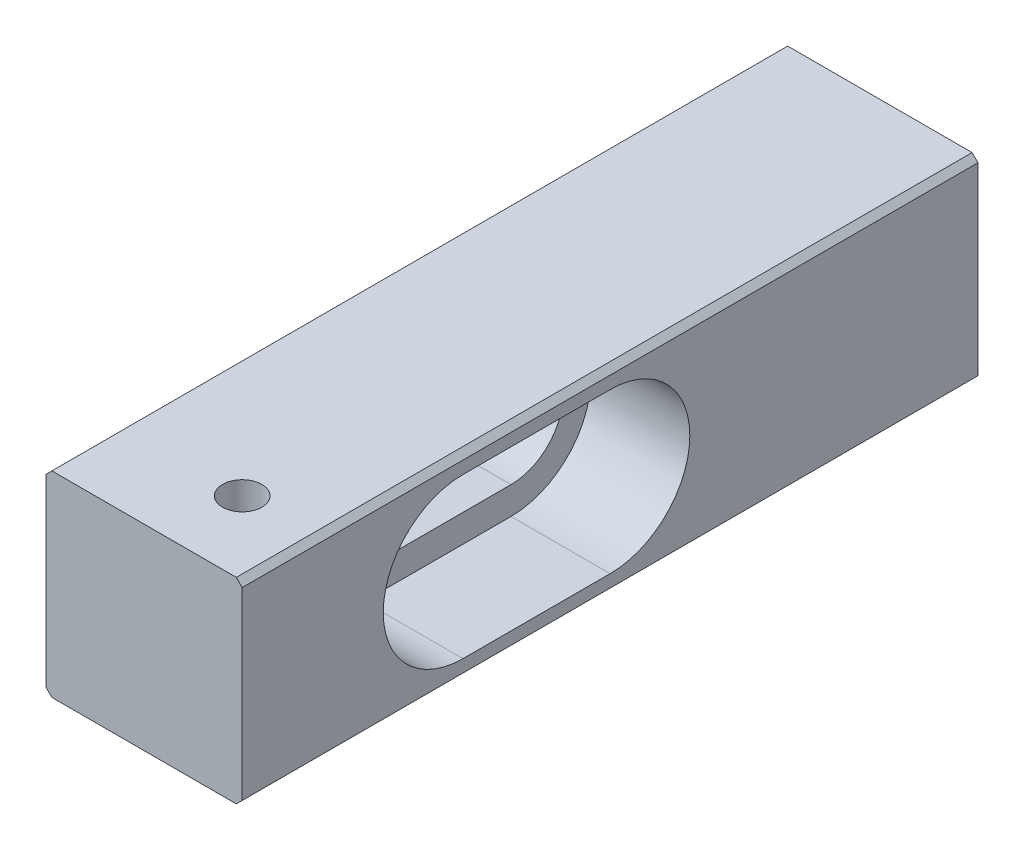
SolidWorks part; units mm, degrees
ref_plane "Front" through (0, 0, 0) normal (0, 0, 1) x (1, 0, 0)
ref_plane "Top" through (0, 0, 0) normal (0, 1, 0) x (1, 0, 0)
ref_plane "Right" through (0, 0, 0) normal (1, 0, 0) x (0, 0, -1)
sketch "Sketch1" plane through (0, 0, 0) normal (0, 0, 1) x (1, 0, 0)
  line L0 (-6.35, 12.7) -> (0, 12.7) construction
  line L1 (-6.35, -12.7) -> (19.05, -12.7)
  line L2 (-6.35, -12.7) -> (-6.35, 12.7)
  line L3 (-6.35, 12.7) -> (19.05, 12.7)
  line L4 (19.05, -12.7) -> (19.05, 12.7)
  dimension "D1" = 25.4
extrude "Boss-Extrude1" add sketch "Sketch1" along normal blind 95.25 separate body
hole_wizard "Hole1" positions "Point_Sketch" profile "Profil_Sketch" size "1/4" standard "ANSI Inch"
sketch "Point_Sketch" plane through (19.05, 0.935, 47.7941) normal (-1, 0, 0) x (0, 0, -1)
  line L1 (9.6941, 0.935) -> (-9.3559, 0.935) construction
  point P0 (0.1691, 0.935)
  dimension "D1" = 19.05
sketch "Profil_Sketch" plane through (19.05, 0, 47.625) normal (0, 1, 0) x (0, 0, -1)
  line L0 (0, 0) -> (0, 25.4)
  line L1 (0, 25.4) -> (6.7469, 25.4)
  line L3 (6.7469, 25.4) -> (6.7469, 12.827)
  line L4 (6.7469, 12.827) -> (10.3187, 12.827)
  line L5 (10.3187, 12.827) -> (10.3187, 0)
  line L7 (10.3187, 0) -> (0, 0)
  line L11 (0, -6.35) -> (0, 107.95) construction
  dimension "Diameter" = 13.4937
  dimension "Thru Hole Depth" = 25.4
  dimension "L1" = 12.827
other "usin_LS160<1>"
hole_wizard "Hole11" positions "Point_Sketch1" profile "Profil_Sketch1" tap size "1/4-20" standard "ANSI Inch"
sketch "Point_Sketch1" plane through (7.1081, -12.7, 69.9307) normal (0, 1, 0) x (-1, 0, 0)
  point P0 (-2.4169, 15.7943)
sketch "Profil_Sketch1" plane through (9.525, -12.7, 85.725) normal (1, 0, 0) x (0, 0, -1)
  line L0 (0, 0) -> (0, 25.4)
  line L1 (0, 25.4) -> (2.5527, 25.4)
  line L2 (2.5527, 25.4) -> (2.5527, 0)
  line L5 (2.5527, 0) -> (0, 0)
  line L11 (0, -6.35) -> (0, 107.95) construction
  dimension "Thru Tap Drill Dia." = 5.1054
  dimension "Thru Tap Drill Depth" = 25.4
other "usin_TS230<1>"
other "Move Face1" parameters "D1"=9.525
chamfer "Chamfer1" distance 0.762 angle 45 4 edges at (-6.35, -12.7, 47.625) (-6.35, 12.7, 47.625) (19.05, 12.7, 47.625) (19.05, -12.7, 47.625)
